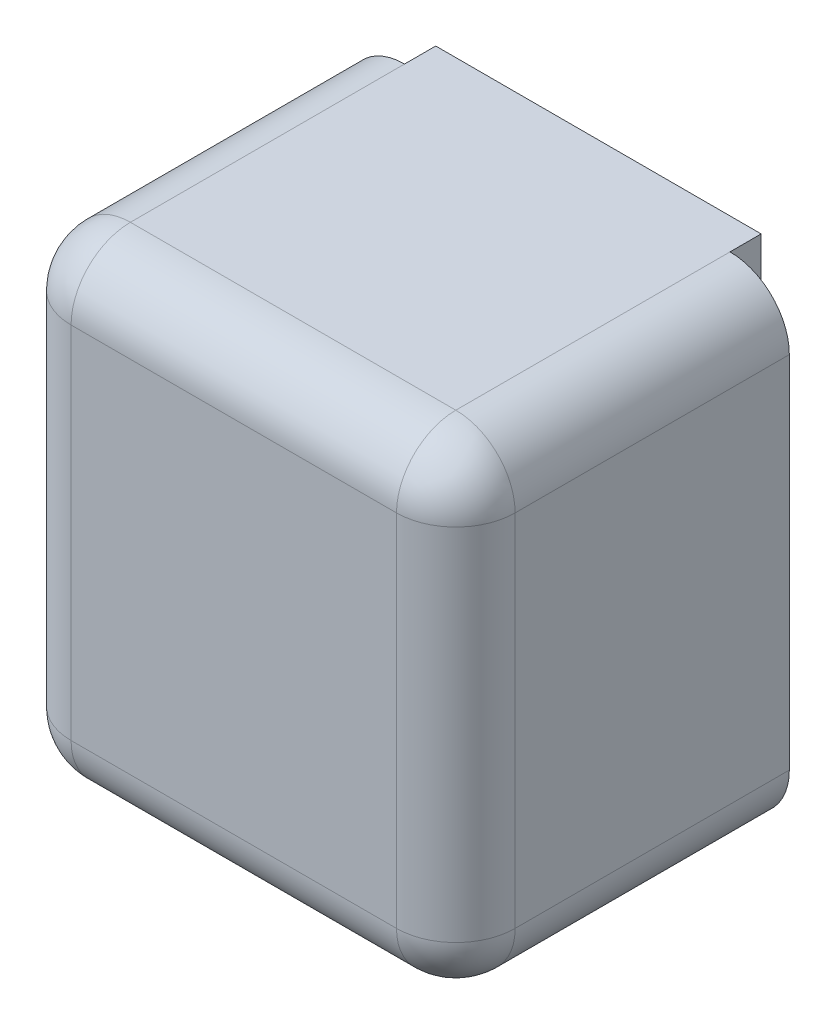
SolidWorks part; units mm, degrees
ref_plane "Front Plane" through (0, 0, 0) normal (0, 0, 1) x (1, 0, 0)
ref_plane "Top Plane" through (0, 0, 0) normal (0, 1, 0) x (1, 0, 0)
ref_plane "Right Plane" through (0, 0, 0) normal (1, 0, 0) x (0, 0, -1)
sketch "Sketch1" plane through (0, 0, 0) normal (0, 0, 1) x (1, 0, 0)
  line L0 (-14.2621, 0) -> (14.2621, 0) construction
  line L1 (-14.2621, 15.367) -> (14.2621, 15.367)
  line L2 (-14.2621, 15.367) -> (-14.2621, -15.367)
  line L3 (-14.2621, -15.367) -> (14.2621, -15.367)
  line L4 (14.2621, 15.367) -> (14.2621, -15.367)
  line L5 (0, 15.367) -> (0, -15.367) construction
  dimension "D1" = 28.5242
  dimension "D2" = 30.734
extrude "Extrude1" add sketch "Sketch1" along normal blind 21.4249
fillet "Fillet1" radius 3.81 4 edges at (14.2621, 0, 21.4249) (0, 15.367, 21.4249) (-14.2621, 0, 21.4249) (0, -15.367, 21.4249)
fillet "Fillet2" radius 3.81 8 edges at (-14.2621, 15.367, 8.8074) (14.2621, 15.367, 8.8075) (14.2621, -15.367, 8.8075) (-14.2621, -15.367, 8.8075) (13.1462, -14.2511, 20.309) (-13.1462, -14.2511, 20.309) (13.1462, 14.2511, 20.309) (-13.1462, 14.2511, 20.309)
sketch "Sketch2" plane through (0, 0, 0) normal (0, 0, -1) x (-1, 0, 0)
  line L0 (-10.4521, 15.367) -> (10.4521, 15.367)
  line L1 (10.4521, 15.367) -> (10.4521, 11.049)
  line L2 (10.4521, 11.049) -> (-10.4521, 11.049)
  line L3 (-10.4521, 11.049) -> (-10.4521, 15.367)
  line L4 (-10.4521, -15.367) -> (-10.4521, -11.049)
  line L5 (-10.4521, -11.049) -> (10.4521, -11.049)
  line L6 (10.4521, -11.049) -> (10.4521, -15.367)
  line L7 (10.4521, -15.367) -> (-10.4521, -15.367)
  dimension "D1" = 4.318
  dimension "D2" = 4.318
extrude "wires" add sketch "Sketch2" along normal blind 2
